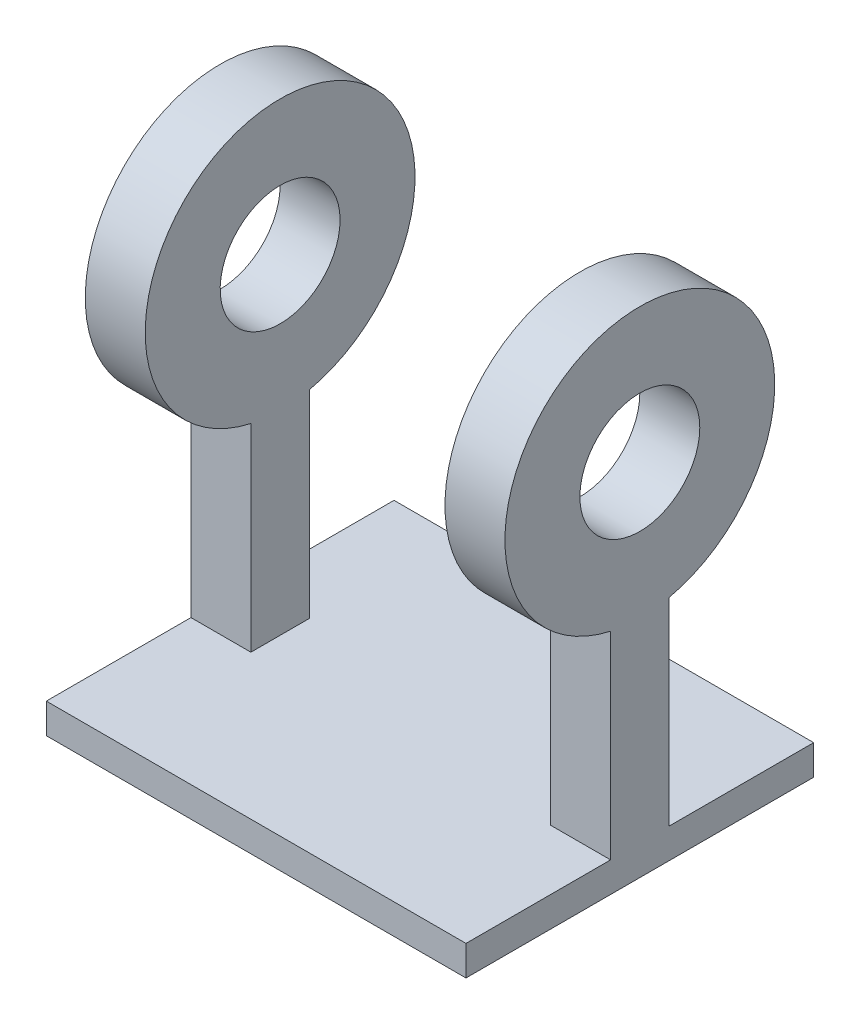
SolidWorks part; units mm, degrees
ref_plane "Plan de face" through (0, 0, 0) normal (0, 0, 1) x (1, 0, 0)
ref_plane "Plan de dessus" through (0, 0, 0) normal (0, 1, 0) x (1, 0, 0)
ref_plane "Plan de droite" through (0, 0, 0) normal (1, 0, 0) x (0, 0, -1)
sketch "Esquisse3" plane through (0, 0, 0) normal (1, 0, 0) x (0, 0, -1)
  line L0 (0, 0) -> (24.125, 0)
  line L1 (24.125, 0) -> (24.125, -5)
  line L2 (24.125, -5) -> (-33.875, -5)
  line L3 (-33.875, -5) -> (-33.875, 0)
  line L4 (-33.875, 0) -> (-9.75, 0)
  line L5 (-9.75, 0) -> (-9.75, 33.0345)
  line L6 (-9.75, 33.0345) -> (0, 33.0345)
  line L7 (0, 33.0345) -> (0, 0)
  circle A0 centre (-4.875, 55) radius 22.5
  circle A1 centre (-4.875, 55) radius 10
  dimension "D6" = 45
  dimension "D7" = 20
  dimension "D1" = 5
  dimension "D2" = 9.75
  dimension "D3" = 58
  dimension "D4" = 24.125
  dimension "D5" = 24.125
  dimension "D8" = 60
extrude "Boss.-Extru.1" add sketch "Esquisse3" along normal blind 70 contours L0 L1 L2 L3 L4 L5 L6 L7
sketch "Esquisse4" plane through (70, 0, 0) normal (1, 0, 0) x (0, 0, -1)
  circle A0 centre (-4.875, 55) radius 22.5
  circle A1 centre (-4.875, 55) radius 10
  dimension "D1" = 20
  dimension "D2" = 45
extrude "Boss.-Extru.2" add sketch "Esquisse4" against normal blind 70
sketch "Esquisse5" plane through (0, 0, 9.75) normal (0, 0, 1) x (1, 0, 0)
  line L0 (70, 0) -> (0, 0) construction
  line L1 (10, 0) -> (60, 0)
  line L2 (10, 0) -> (10, 77.5)
  line L3 (10, 77.5) -> (60, 77.5)
  line L4 (60, 0) -> (60, 77.5)
  line L5 (70, 77.5) -> (0, 77.5) construction
  line L6 (0, 77.5) -> (0, 33.0345) construction
  dimension "D1" = 50
  dimension "D2" = 10
extrude "Enlèv. mat.-Extru.3" cut sketch "Esquisse5" against normal blind 43
sketch "Esquisse8" plane through (0, 0, 9.75) normal (0, 0, -1) x (-1, 0, 0)
  line L1 (-60, 33.0345) -> (-10, 33.0345)
  line L2 (-60, 33.0345) -> (-60, 76.9655)
  line L3 (-60, 76.9655) -> (-10, 76.9655)
  line L4 (-10, 33.0345) -> (-10, 76.9655)
extrude "Enlèv. mat.-Extru.4" cut sketch "Esquisse8" against normal blind 43
